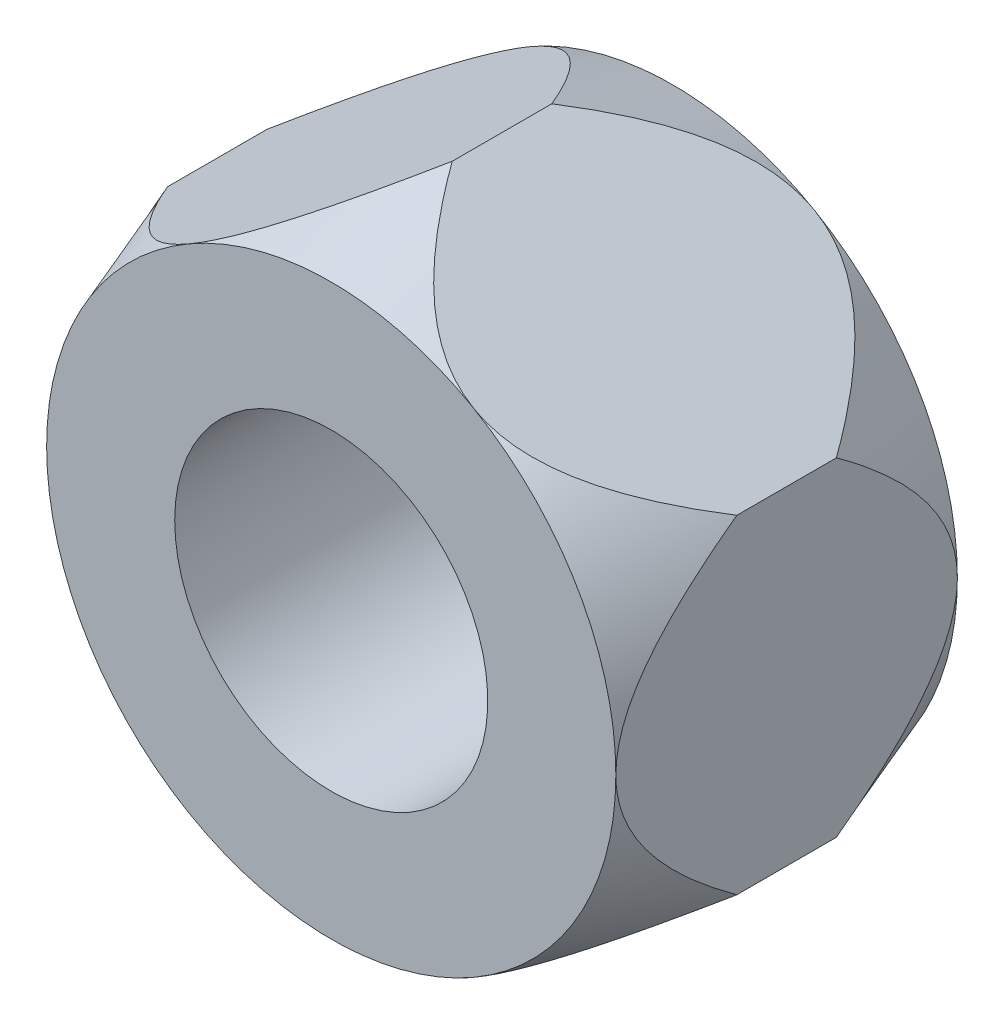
SolidWorks part; units mm, degrees
ref_plane "Front Plane" through (0, 0, 0) normal (0, 0, 1) x (1, 0, 0)
ref_plane "Top Plane" through (0, 0, 0) normal (0, 1, 0) x (1, 0, 0)
ref_plane "Right Plane" through (0, 0, 0) normal (1, 0, 0) x (0, 0, -1)
sketch "Sketch1" plane through (0, 0, 0) normal (0, 0, 1) x (1, 0, 0)
  line L1 (0, 5.7735) -> (-5, 2.8868)
  line L2 (-5, 2.8868) -> (-5, -2.8868)
  line L3 (-5, -2.8868) -> (0, -5.7735)
  line L4 (0, -5.7735) -> (5, -2.8868)
  line L5 (5, -2.8868) -> (5, 2.8868)
  line L6 (5, 2.8868) -> (0, 5.7735)
  circle A0 centre (0, 0) radius 5 construction
extrude "Boss-Extrude1" add sketch "Sketch1" along normal blind 6
sketch "Sketch2" plane through (0, 0, 6) normal (0, 0, 1) x (1, 0, 0)
  circle A0 centre (0, 0) radius 5
extrude "Cut-Extrude1" cut sketch "Sketch2" against normal blind 6 draft 20 flip side to cut
sketch "Sketch3" plane through (0, 0, 0) normal (0, 0, -1) x (-1, 0, 0)
  circle A0 centre (0, 0) radius 5
extrude "Cut-Extrude2" cut sketch "Sketch3" against normal blind 6 draft 20 flip side to cut
sketch "Sketch4" plane through (0, 0, 0) normal (0, 0, -1) x (-1, 0, 0)
  circle A0 centre (0, 0) radius 2.75
  dimension "D1" = 5.5
extrude "Cut-Extrude3" cut sketch "Sketch4" against normal blind 6
